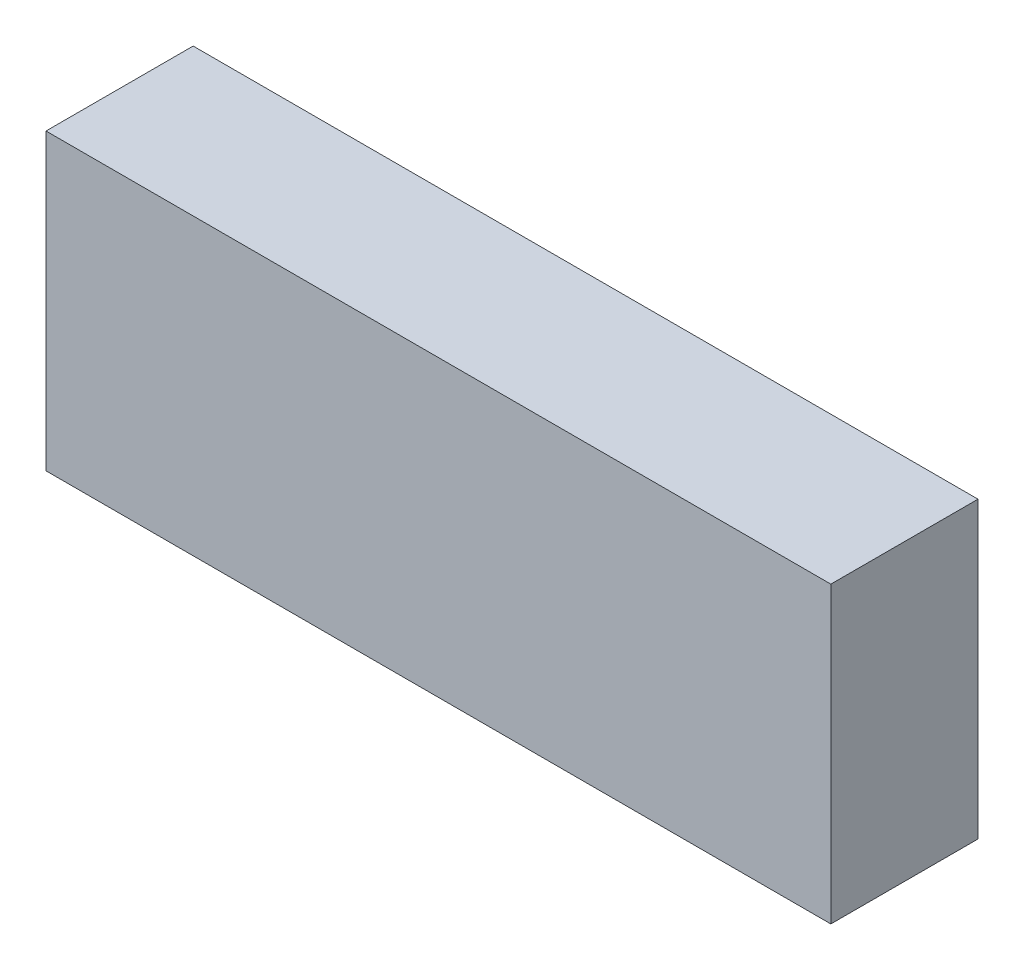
SolidWorks part; units mm, degrees
ref_plane "Front Plane" through (0, 0, 0) normal (0, 0, 1) x (1, 0, 0)
ref_plane "Top Plane" through (0, 0, 0) normal (0, 1, 0) x (1, 0, 0)
ref_plane "Right Plane" through (0, 0, 0) normal (1, 0, 0) x (0, 0, -1)
sketch "Sketch1" plane through (0, 0, 0) normal (0, 1, 0) x (1, 0, 0)
  line L1 (-101.6, -19.05) -> (101.6, -19.05)
  line L2 (-101.6, -19.05) -> (-101.6, 19.05)
  line L3 (-101.6, 19.05) -> (101.6, 19.05)
  line L4 (101.6, -19.05) -> (101.6, 19.05)
  line L5 (-101.6, -19.05) -> (101.6, 19.05) construction
  line L6 (-101.6, 19.05) -> (101.6, -19.05) construction
  point P0 (0, 0)
  dimension "D1" = 203.2
  dimension "D2" = 38.1
extrude "Boss-Extrude1" add sketch "Sketch1" along normal blind 76.2
